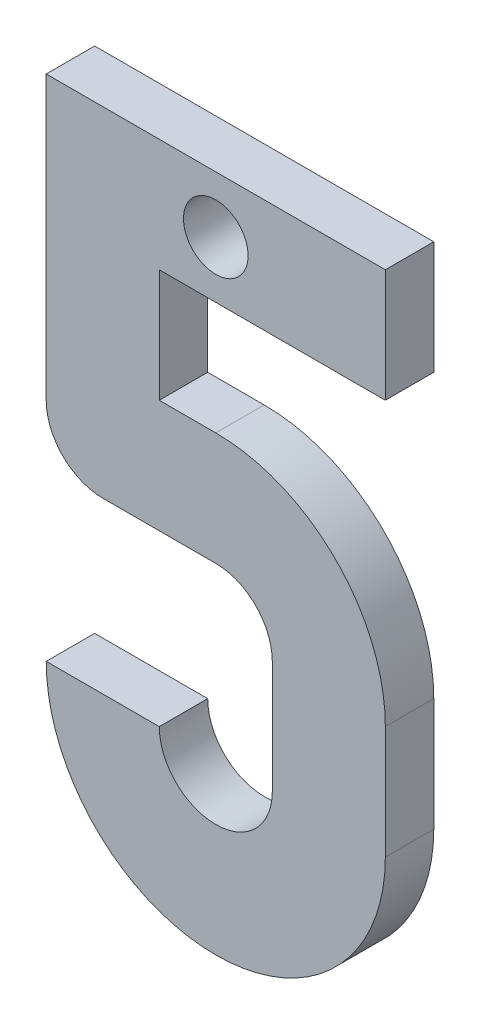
SolidWorks part; units mm, degrees
ref_plane "Front Plane" through (0, 0, 0) normal (0, 0, 1) x (1, 0, 0)
ref_plane "Top Plane" through (0, 0, 0) normal (0, 1, 0) x (1, 0, 0)
ref_plane "Right Plane" through (0, 0, 0) normal (1, 0, 0) x (0, 0, -1)
sketch "Sketch1" plane through (0, 0, 0) normal (0, 0, 1) x (1, 0, 0)
  line L0 (21, 0) -> (0, 0) construction
  line L1 (0, 0) -> (0, 21) construction
  line L2 (21, 0) -> (10, 0) construction
  line L3 (21, 7) -> (0, 7) construction
  line L4 (21, 7) -> (10, 7) construction
  line L5 (20.3995, 14) -> (0, 14) construction
  line L6 (20.3995, 14) -> (10, 14) construction
  line L7 (21, 21) -> (3.5, 21) construction
  line L8 (21, 21) -> (10, 21) construction
  line L9 (10.5, 28) -> (0, 28) construction
  line L10 (10.5, 28) -> (10, 28) construction
  line L11 (21, 35) -> (0, 35) construction
  line L12 (21, 35) -> (10, 35) construction
  line L13 (21, 42) -> (0, 42) construction
  line L14 (21, 42) -> (10, 42) construction
  line L15 (7, 0) -> (7, 42) construction
  line L16 (14, 0) -> (14, 42) construction
  line L17 (21, 0) -> (21, 42) construction
  line L18 (10.5, 42) -> (10.5, 0) construction
  line L19 (21, 35) -> (21, 42)
  line L20 (21, 42) -> (0, 42)
  line L21 (0, 42) -> (0, 24.5)
  line L22 (3.5, 21) -> (10.5, 21)
  line L23 (21, 35) -> (7, 35)
  line L24 (7, 35) -> (7, 28)
  line L25 (7, 28) -> (10.5, 28)
  line L26 (7, 10.5) -> (0, 10.5)
  line L27 (21, 17.5) -> (21, 10.5)
  line L28 (14, 17.5) -> (14, 10.5)
  line L29 (0, 24.5) -> (0, 42) construction
  arc A0 (0, 10.5) -> (21, 10.5) centre (10.5, 10.5) ccw
  arc A1 (21, 17.5) -> (10.5, 28) centre (10.5, 17.5) ccw
  arc A2 (7, 10.5) -> (14, 10.5) centre (10.5, 10.5) ccw
  arc A3 (14, 17.5) -> (10.5, 21) centre (10.5, 17.5) ccw
  arc A4 (0, 24.5) -> (3.5, 21) centre (3.5, 24.5) ccw
  arc A5 (0, 24.5) -> (3.5, 21) centre (3.5, 24.5) ccw
  circle A6 centre (10.5, 38.5) radius 2
  dimension "D1" = 21
  dimension "D2" = 21
  dimension "D3" = 4
  dimension "D4" = 3.5
  dimension "D5" = 3.5
extrude "Extrude1" add sketch "Sketch1" along normal blind 3 contours L21 A5 L22 A3 L28 A2 L26 A0 L27 A1 L25 L24 L23 L19 L20
